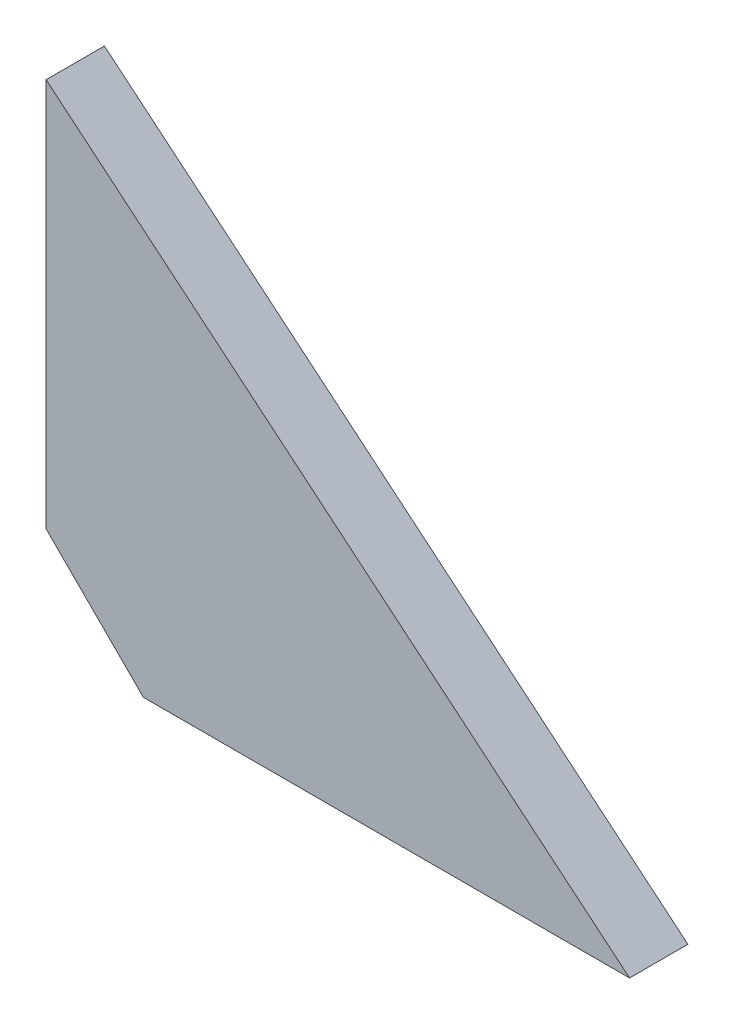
SolidWorks part; units mm, degrees
ref_plane "前视基准面" through (0, 0, 0) normal (0, 0, 1) x (1, 0, 0)
ref_plane "上视基准面" through (0, 0, 0) normal (0, 1, 0) x (1, 0, 0)
ref_plane "右视基准面" through (0, 0, 0) normal (1, 0, 0) x (0, 0, -1)
sketch "草图1" plane through (0, 0, 0) normal (0, 0, 1) x (1, 0, 0)
  line L0 (0, 50) -> (0, 0)
  line L1 (0, 0) -> (60, 0)
  line L2 (60, 0) -> (0, 50)
  dimension "D1" = 50
  dimension "D2" = 60
extrude "拉伸1" add sketch "草图1" along normal blind 6
chamfer "倒角1" distance 10 angle 45 1 edges at (0, 0, 3)
